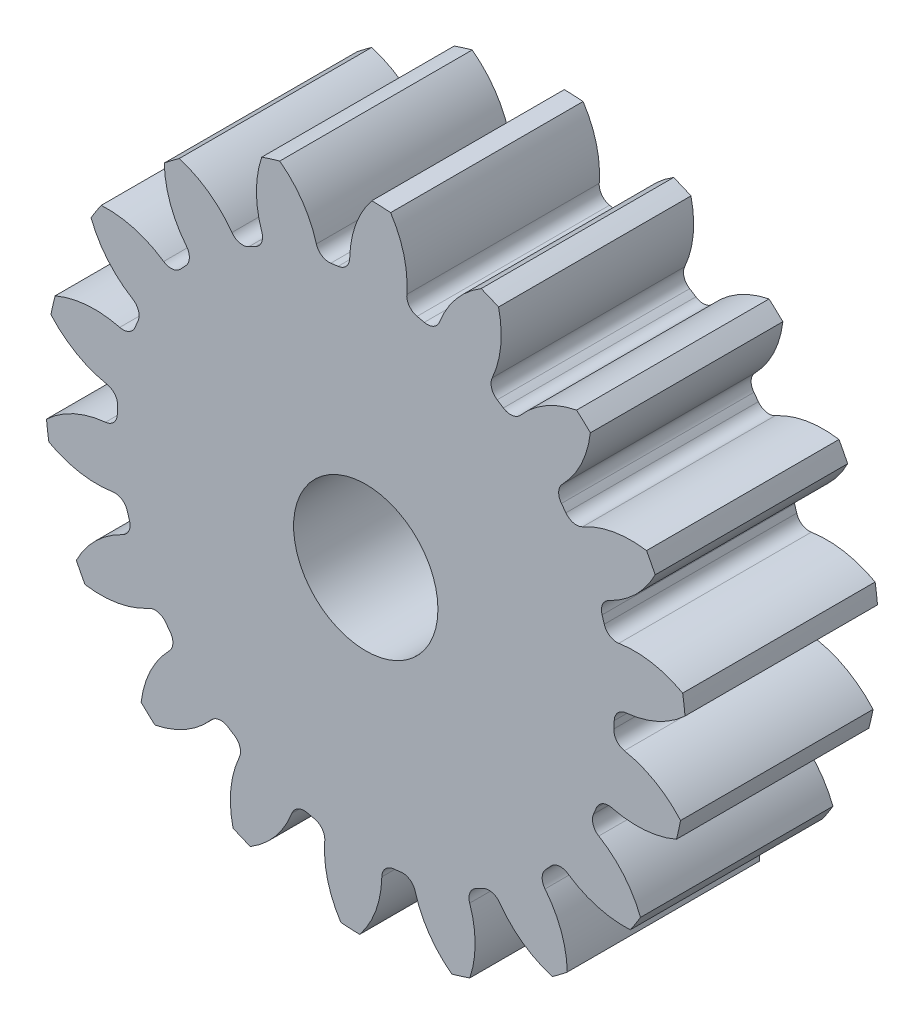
SolidWorks part; units mm, degrees
ref_plane "Front" through (0, 0, 0) normal (0, 0, 1) x (1, 0, 0)
ref_plane "Top" through (0, 0, 0) normal (0, 1, 0) x (1, 0, 0)
ref_plane "Right" through (0, 0, 0) normal (1, 0, 0) x (0, 0, -1)
sketch "Sketch3" plane through (0, 0, 0) normal (0, 0, 1) x (1, 0, 0)
  circle A0 centre (0, 0) radius 169.3333
  dimension "od" = 338.6667
extrude "gearBody" add sketch "Sketch3" along normal blind 101.6
sketch "Sketch2" plane through (0, 0, 0) normal (0, 0, 1) x (1, 0, 0)
  line L0 (0, 0) -> (132.308, 54.8038) construction
  line L1 (166.8936, -33.386) -> (0, 0) construction
  line L2 (0, 0) -> (36.3143, 0) construction
  line L3 (152.2848, 5.9247) -> (151.0061, -20.5649) construction
  line L5 (151.6455, -7.3201) -> (0, 0) construction
  line L7 (0, 0) -> (143.2092, 0) construction
  arc A0 (143.1749, 3.1303) -> (142.2078, -16.9061) centre (0, 0) ccw construction
  arc A1 (168.5382, 16.3901) -> (166.176, -32.5472) centre (0, 0) ccw construction
  arc A2 (152.2848, 5.9247) -> (151.0061, -20.5649) centre (0, 0) ccw construction
  arc A3 (130.9726, -8.2685) -> (131.1601, -4.385) centre (0, 0) ccw
  arc A4 (166.8936, -33.386) -> (136.5304, -15.4669) centre (126.4143, -67.2926) ccw
  arc A5 (166.8936, -33.386) -> (169.3333, 17.1559) centre (0, 0) ccw
  arc A6 (169.3333, 17.1559) -> (137.3854, 2.2447) centre (132.308, 54.8038) cw
  arc A7 (131.1601, -4.385) -> (137.3854, 2.2447) centre (138.0481, -4.6152) cw
  arc A8 (136.5304, -15.4669) -> (130.9726, -8.2685) centre (137.8508, -8.7027) cw
  point P6 (169.3333, 17.1559)
  point P22 (166.8936, -33.386)
  dimension "baseDia" = 286.4183
  dimension "od" = 338.6667
  dimension "pd" = 304.8
  dimension "rd" = 262.4667
  dimension "rFillet" = 6.8919
  dimension "pointX" = 169.3333
  dimension "pointY" = 17.1559
  dimension "CTT" = 26.4896
  dimension "flankCenterAngle" = 22.5
extrude "toothCut" cut sketch "Sketch2" along normal through all
pattern_circular "CirPattern1" count 18 over 360 about axis through (0, 0, 0) along (0, 0, 1) of "toothCut"
sketch "hub1Dia" plane through (0, 0, 0) normal (0, 0, -1) x (-1, 0, 0)
  circle A0 centre (0, 0) radius 12.7
  dimension "hub1Dia" = 25.4
sketch "hub2Dia" plane through (0, 0, 101.6) normal (0, 0, 1) x (1, 0, 0)
  circle A0 centre (0, 0) radius 12.7
  dimension "hub2dia" = 25.4
sketch "boreDia" plane through (0, 0, 0) normal (0, 0, 1) x (1, 0, 0)
  circle A0 centre (0, 0) radius 38.1
  dimension "boreDia" = 76.2
extrude "bore" cut sketch "boreDia" against normal mid plane 25400
